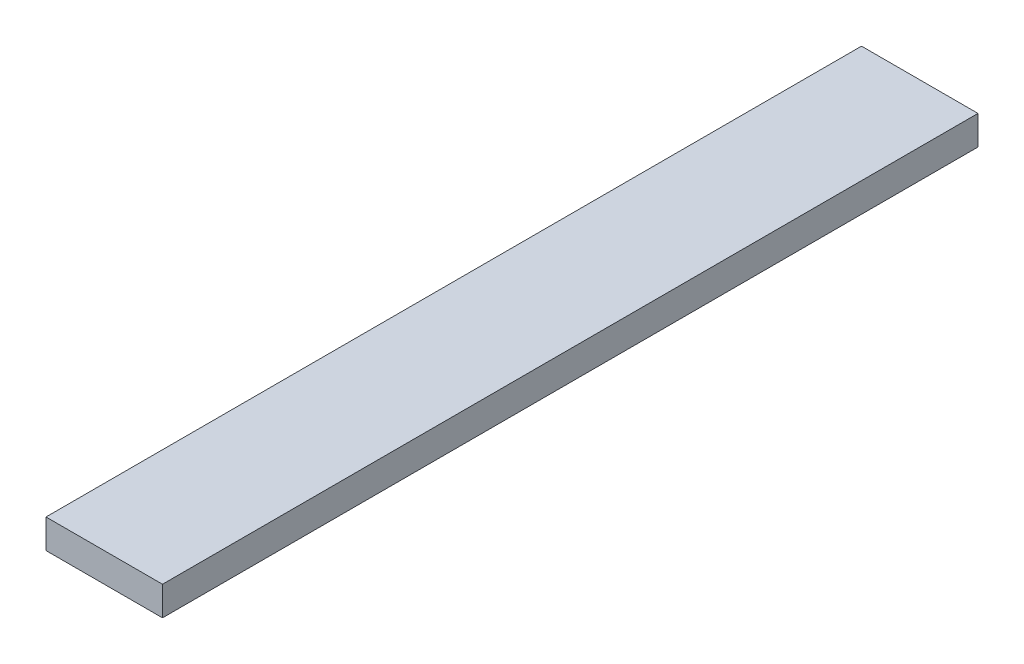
SolidWorks part; units mm, degrees
ref_plane "Plan de face" through (0, 0, 0) normal (0, 0, 1) x (1, 0, 0)
ref_plane "Plan de dessus" through (0, 0, 0) normal (0, 1, 0) x (1, 0, 0)
ref_plane "Plan de droite" through (0, 0, 0) normal (1, 0, 0) x (0, 0, -1)
sketch "Esquisse1" plane through (0, 0, 0) normal (0, 0, 1) x (1, 0, 0)
  line L1 (0, 0) -> (20, 0)
  line L2 (0, 0) -> (0, 5)
  line L3 (0, 5) -> (20, 5)
  line L4 (20, 0) -> (20, 5)
  dimension "D1" = 20
  dimension "D2" = 5
extrude "Extrusion1" add sketch "Esquisse1" along normal blind 140
